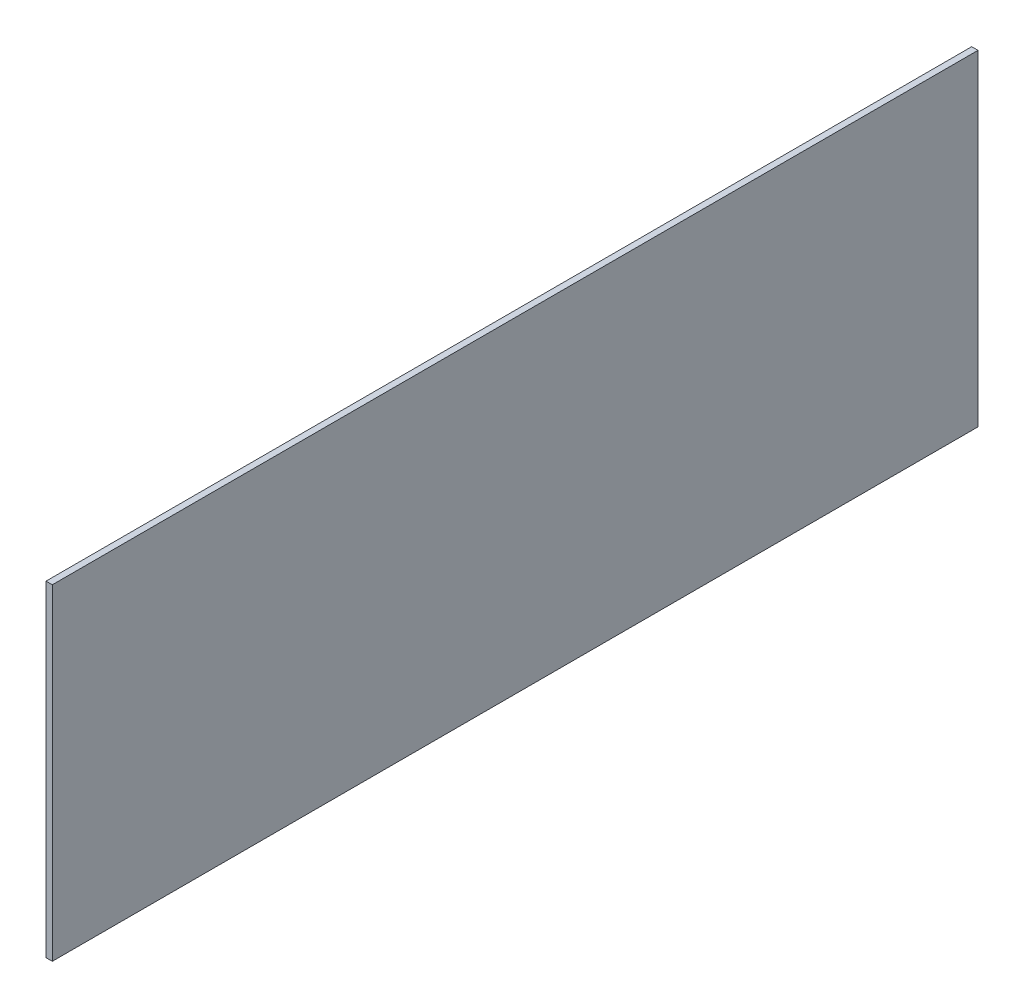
SolidWorks part; units mm, degrees
ref_plane "Alzado" through (0, 0, 0) normal (0, 0, 1) x (1, 0, 0)
ref_plane "Planta" through (0, 0, 0) normal (0, 1, 0) x (1, 0, 0)
ref_plane "Vista lateral" through (0, 0, 0) normal (1, 0, 0) x (0, 0, -1)
sketch "Sketch1" plane through (0, 0, 0) normal (1, 0, 0) x (0, 0, -1)
  line L1 (0, 0) -> (440, 0)
  line L2 (0, 0) -> (0, 155)
  line L3 (0, 155) -> (440, 155)
  line L4 (440, 0) -> (440, 155)
  dimension "D1" = 440
  dimension "D2" = 155
extrude "Boss-Extrude1" add sketch "Sketch1" along normal blind 3
